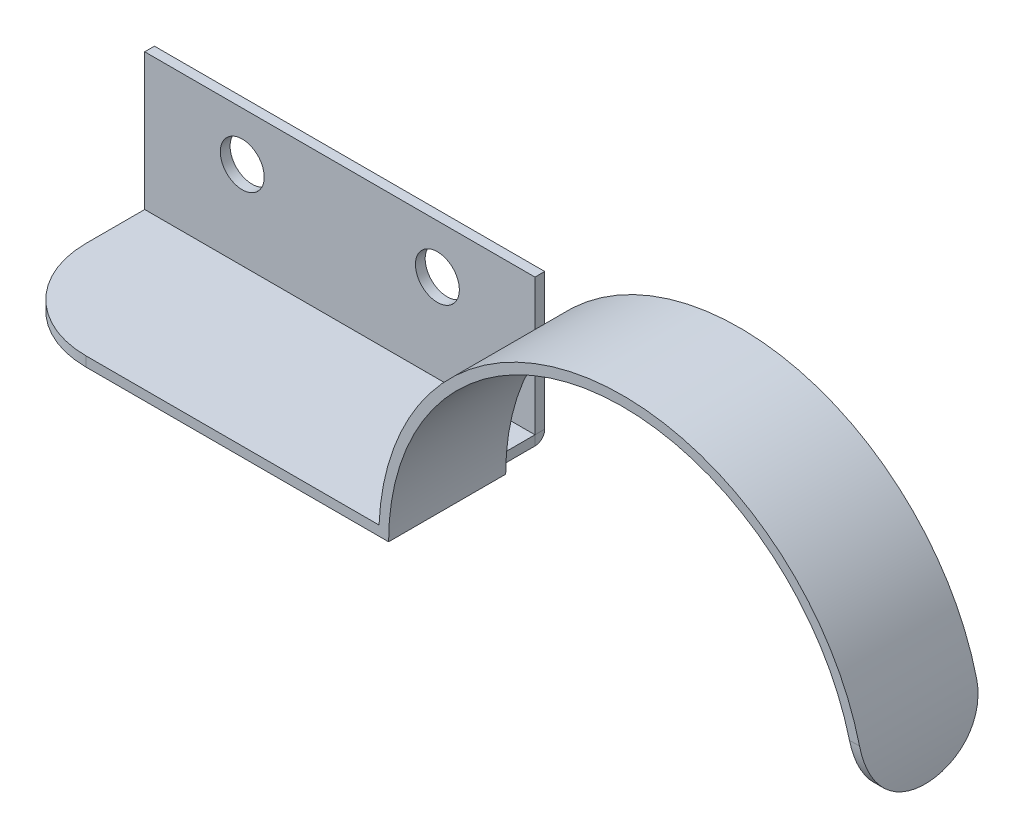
SolidWorks part; units mm, degrees
ref_plane "Front Plane" through (0, 0, 0) normal (0, 0, 1) x (1, 0, 0)
ref_plane "Top Plane" through (0, 0, 0) normal (0, 1, 0) x (1, 0, 0)
ref_plane "Right Plane" through (0, 0, 0) normal (1, 0, 0) x (0, 0, -1)
sketch "Sketch1" plane through (0, 0, 0) normal (0, 0, 1) x (1, 0, 0)
  line L1 (10, 0) -> (40, 0)
  line L2 (0, 10) -> (0, 30)
  line L3 (0, 30) -> (40, 30)
  line L4 (40, 0) -> (40, 30)
  circle A0 centre (10, 25) radius 2.25
  circle A1 centre (30, 25) radius 2.25
  arc A2 (10, 0) -> (0, 10) centre (10, 10) cw
  point P11 (0, 0)
  dimension "D3" = 4.5
  dimension "D4" = 10
  dimension "D5" = 10
  dimension "D6" = 5
  dimension "D7" = 5
  dimension "D8" = 10
  dimension "D1" = 40
  dimension "D2" = 30
sheet metal parameters "Sheet-Metal1" thickness 1 parameters "D1"=0.0001
base flange "Base-Flange1" sketch "Sketch1" thickness 1 reverse thickness direction yes parameters "D1"=0.0001
sketch "Sketch3" plane through (0, 0, 1) normal (0, 0, 1) x (1, 0, 0)
  line L0 (0, 16) -> (40, 16)
  line L1 (0, 30) -> (0, 10) construction
  line L2 (40, 0) -> (40, 30) construction
  line L3 (40, 30) -> (0, 30) construction
  dimension "D1" = 14
sketched bend "Sketched Bend1" parameters "D1"=0.001
bend "SketchBend1" bend radius 0.0001 bend angle 90 parameters "D5"=1
sketch "Sketch5" plane through (0, 0, 16.9999) normal (0, 0, 1) x (1, 0, 0)
  line L0 (40, 14.9999) -> (41, 14.9999)
  line L1 (41, 14.9999) -> (89, 14.9999) construction
  line L2 (89, 14.9999) -> (90, 14.9999)
  line L3 (40, 15.9999) -> (40.02, 15.9999)
  line L4 (40, 15.9999) -> (40, 14.9999)
  arc A0 (90, 14.9999) -> (40.02, 15.9999) centre (65, 14.9999) ccw
  arc A1 (89, 14.9999) -> (41, 14.9999) centre (65, 14.9999) ccw
  dimension "D1" = 1
  dimension "D2" = 24
extrude "Extrude1" add sketch "Sketch5" against normal blind 12
ref_plane "Plane1" through (90, 0, 0) normal (1, 0, 0) x (0, 0, -1)
sketch "Sketch6" plane through (90, 0, 0) normal (1, 0, 0) x (0, 0, -1)
  line L0 (-10.9999, 14.9999) -> (-10.9999, 20.9999) construction
  line L1 (-4.9999, 14.9999) -> (-16.9999, 14.9999) construction
  line L2 (-4.9999, 20.9999) -> (-4.9999, 14.9999)
  line L5 (-4.9999, 14.9999) -> (-16.9999, 14.9999)
  line L6 (-16.9999, 14.9999) -> (-16.9999, 20.9999)
  arc A0 (-16.9999, 20.9999) -> (-4.9999, 20.9999) centre (-10.9999, 20.9999) ccw
  dimension "D1" = 6
extrude "Extrude2" cut sketch "Sketch6" against normal blind 12 contours A0 L6 L5 | A0 L5 L2
flat pattern "Flat-Pattern1"
sketch "Bend-Lines1" plane through (0, 0, 0) normal (0, 1, 0) x (-1, 0, 0)
bend of the flat pattern "Flatten-<SketchBend1>1"
